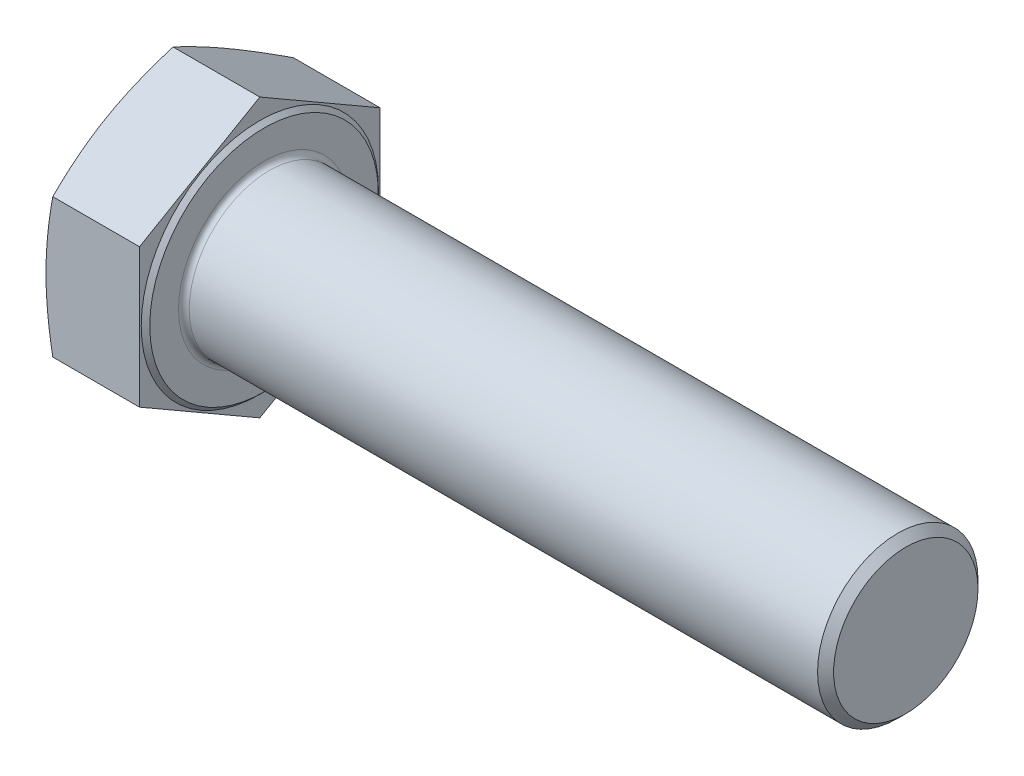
SolidWorks part; units mm, degrees
ref_plane "Front" through (0, 0, 0) normal (0, 0, 1) x (1, 0, 0)
ref_plane "Top" through (0, 0, 0) normal (0, 1, 0) x (1, 0, 0)
ref_plane "Right" through (0, 0, 0) normal (1, 0, 0) x (0, 0, -1)
sketch "Sketch2" plane through (0, 0, 0) normal (1, 0, 0) x (0, 0, -1)
  line L1 (0, -25.9808) -> (22.5, -12.9904)
  line L2 (22.5, -12.9904) -> (22.5, 12.9904)
  line L3 (22.5, 12.9904) -> (0, 25.9808)
  line L4 (0, 25.9808) -> (-22.5, 12.9904)
  line L5 (-22.5, 12.9904) -> (-22.5, -12.9904)
  line L6 (-22.5, -12.9904) -> (0, -25.9808)
  circle A0 centre (0, 0) radius 22.5 construction
  dimension "s" = 45
extrude "BaseHead" add sketch "Sketch2" along normal blind 18.28
sketch "Sketch3" plane through (0, 0, 0) normal (0, 0, 1) x (1, 0, 0)
  line L0 (18.28, 25.9808) -> (18.28, 21.375)
  line L2 (18.28, 21.375) -> (17.48, 22.175)
  line L3 (17.48, 22.175) -> (17.48, 25.9808)
  line L5 (17.48, 25.9808) -> (18.28, 25.9808)
  line L6 (-0.9571, 0) -> (7.6478, 0) construction
  line L7 (18.28, 25.9808) -> (0, 25.9808) construction
  dimension "D1" = 45
  dimension "c" = 0.8
  dimension "dw" = 42.75
revolve "BearingFace" cut sketch "Sketch3" angle 360 about L6
sketch "Sketch4" plane through (0, 0, 0) normal (0, 0, 1) x (1, 0, 0)
  line L0 (-0.4935, 0) -> (3.5626, 0) construction
  line L2 (0, 25.9808) -> (1.2669, 25.9808)
  line L4 (1.2669, 25.9808) -> (0, 22.5)
  line L6 (0, 22.5) -> (0, 25.9808)
  line L7 (17.48, 25.9808) -> (0, 25.9808) construction
  dimension "D1" = 20
  dimension "D2" = 45
revolve "HeadChamfer" cut sketch "Sketch4" angle 360 about L0
ref_plane "Plane1" through (72.28, 0, 0) normal (1, 0, 0) x (0, 0, -1)
sketch "Sketch5" plane through (18.28, 0, 0) normal (1, 0, 0) x (0, 0, -1)
  circle A0 centre (0, 0) radius 15
  dimension "d" = 30
extrude "BaseBody" add sketch "Sketch5" along normal blind 120
chamfer "Chamfer1" distance 1.5 angle 45 1 edges at (138.28, 0, -15)
fillet "HeadFillet" radius 1 1 edges at (18.28, 0, 15)
equation "\"D2@Sketch4\" = \"s@Sketch2\""
equation "\"b@ThreadCosmetic1\" = \"l@BaseBody\" - \"lg@Plane1\""
equation "\"D1@Chamfer1\" = 0.05 * \"d@Sketch5\""
